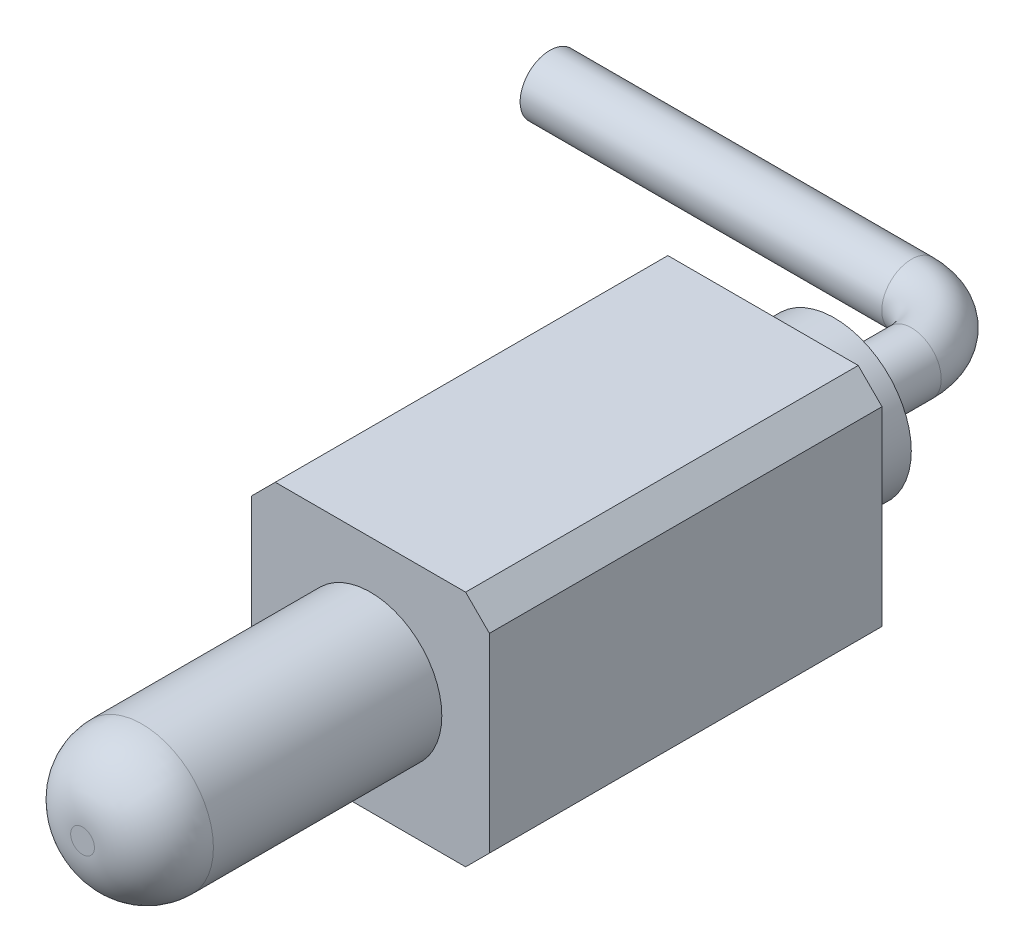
SolidWorks part; units mm, degrees
ref_plane "Front Plane" through (0, 0, 0) normal (0, 0, 1) x (1, 0, 0)
ref_plane "Top Plane" through (0, 0, 0) normal (0, 1, 0) x (1, 0, 0)
ref_plane "Right Plane" through (0, 0, 0) normal (1, 0, 0) x (0, 0, -1)
sketch "Sketch1" plane through (0, 0, 0) normal (0, 0, 1) x (1, 0, 0)
  line L0 (2.286, 2.54) -> (2.54, 2.286)
  line L1 (0.254, 0) -> (2.286, 0)
  line L2 (0, 0.254) -> (0, 2.286)
  line L3 (0.254, 2.54) -> (2.286, 2.54)
  line L4 (2.54, 0.254) -> (2.54, 2.286)
  line L5 (2.286, 0) -> (2.54, 0.254)
  line L6 (0, 0.254) -> (0.254, 0)
  line L7 (0, 2.286) -> (0.254, 2.54)
  point P0 (0, 0)
  point P1 (2.54, 2.54)
  point P2 (0, 2.54)
  point P3 (2.54, 0)
  dimension "D1" = 2.54
  dimension "D2" = 2.54
extrude "Boss-Extrude1" add sketch "Sketch1" along normal blind 4.191
sketch "Sketch2" plane through (0, 0, 4.191) normal (0, 0, 1) x (1, 0, 0)
  line L0 (1.27, 2.54) -> (1.27, 0) construction
  line L2 (2.286, 2.54) -> (0.254, 2.54) construction
  line L3 (0.254, 0) -> (2.286, 0) construction
  circle A0 centre (1.27, 1.27) radius 0.762
  dimension "D1" = 1.524
extrude "Boss-Extrude2" add sketch "Sketch2" along normal blind 3.0734
fillet "Fillet2" radius 0.635 1 edges at (2.032, 1.27, 7.2644)
sketch "Sketch3" plane through (0, 0, 0) normal (-1, 0, 0) x (0, 0, 1)
  line L0 (0, 1.27) -> (-2.2201, 1.27) construction
  line L1 (0, 2.286) -> (0, 0.254) construction
  circle A0 centre (-2.2201, 1.27) radius 0.3175
  dimension "D1" = 0.635
extrude "Boss-Extrude3" add sketch "Sketch3" along normal blind 3.2258 separate body
sketch "Sketch4" plane through (0, 0, 0) normal (0, 0, -1) x (-1, 0, 0)
  line L0 (-1.27, 0) -> (-1.27, 2.54) construction
  line L1 (-0.254, 0) -> (-2.286, 0) construction
  line L2 (-2.286, 2.54) -> (-0.254, 2.54) construction
  circle A0 centre (-1.27, 1.27) radius 0.8206
extrude "Boss-Extrude4" add sketch "Sketch4" along normal blind 0.762
sketch "Sketch5" plane through (0, 0, 0) normal (1, 0, 0) x (0, 0, -1)
  circle A0 centre (2.2201, 1.27) radius 0.3175
sketch3d "3DSketch1"
  line L0 (0, 1.27, -2.2201) -> (0.635, 1.27, -2.2201)
  line L1 (1.27, 1.27, -1.5851) -> (1.27, 1.27, -0.762)
  line L2 (1.27, 1.27, -0.762) -> (1.27, 1.27, 0) construction
  arc A0 (0.635, 1.27, -2.2201) -> (1.27, 1.27, -1.5851) centre (0.635, 1.27, -1.5851) ccw
  point P8 (1.27, 1.27, -2.2201)
  point P9 (0.635, 0.635, -1.5851)
  dimension "D1" = 0.635
sweep "Sweep1" add profiles "Sketch5" path "3DSketch1"
